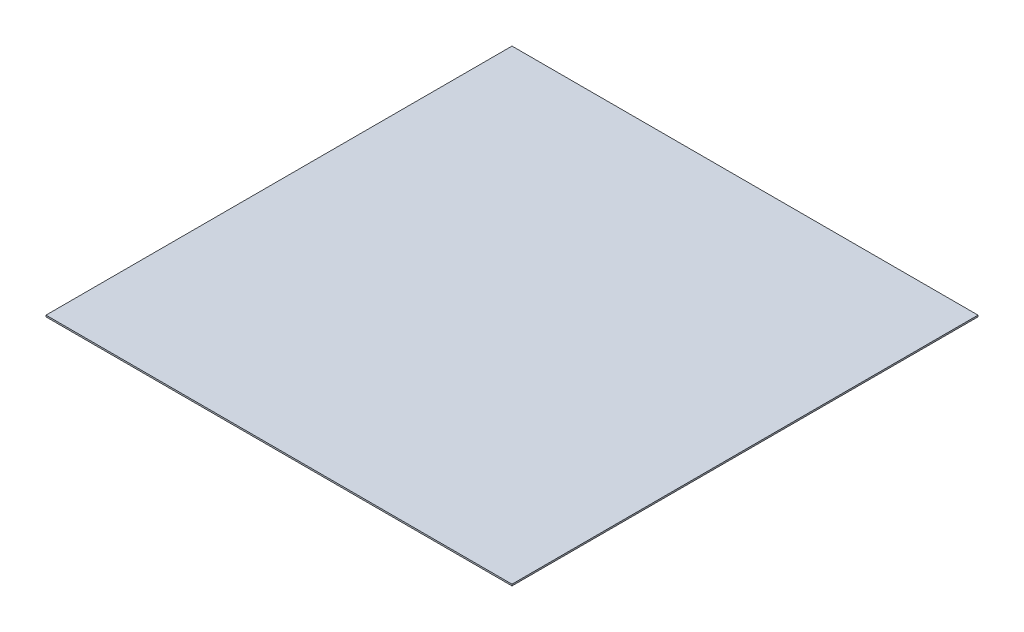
SolidWorks part; units mm, degrees
ref_plane "Front Plane" through (0, 0, 0) normal (0, 0, 1) x (1, 0, 0)
ref_plane "Top Plane" through (0, 0, 0) normal (0, 1, 0) x (1, 0, 0)
ref_plane "Right Plane" through (0, 0, 0) normal (1, 0, 0) x (0, 0, -1)
sketch "Sketch1" plane through (0, 0, 0) normal (0, 1, 0) x (1, 0, 0)
  line L1 (-150, -150) -> (150, -150)
  line L2 (-150, -150) -> (-150, 150)
  line L3 (-150, 150) -> (150, 150)
  line L4 (150, -150) -> (150, 150)
  line L5 (-150, -150) -> (150, 150) construction
  line L6 (-150, 150) -> (150, -150) construction
  point P0 (0, 0)
  dimension "D1" = 300
extrude "Boss-Extrude1" add sketch "Sketch1" along normal blind 1
